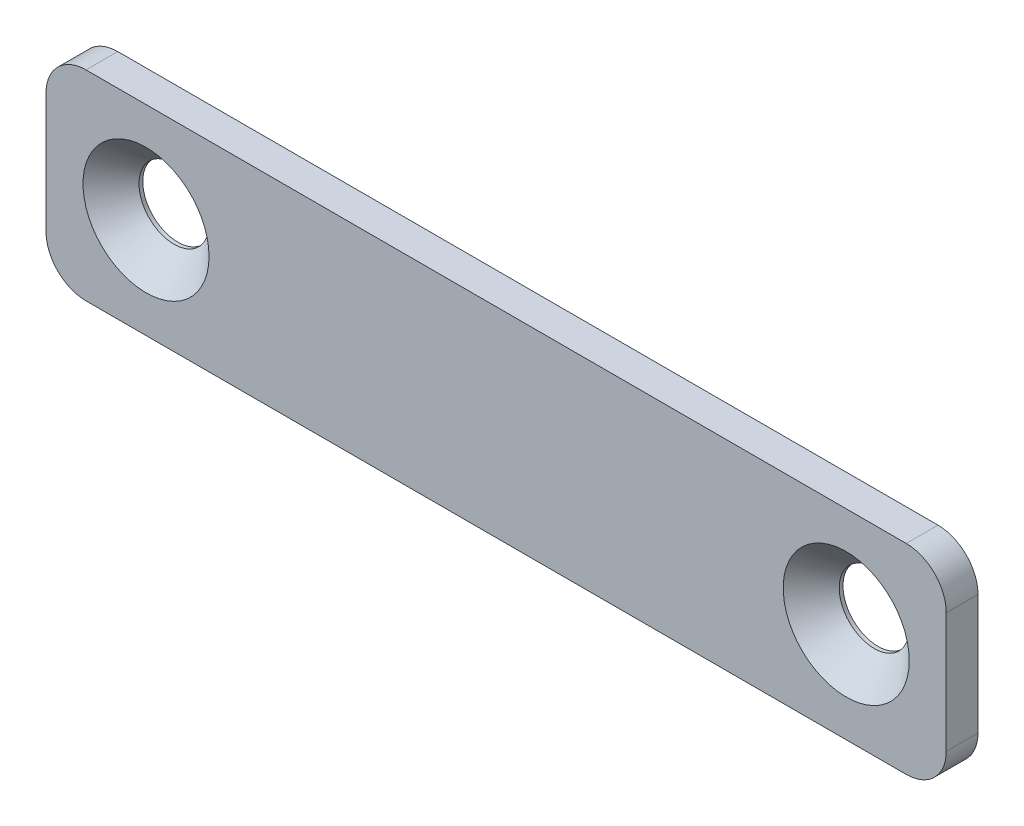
SolidWorks part; units mm, degrees
ref_plane "Front Plane" through (0, 0, 0) normal (0, 0, 1) x (1, 0, 0)
ref_plane "Top Plane" through (0, 0, 0) normal (0, 1, 0) x (1, 0, 0)
ref_plane "Right Plane" through (0, 0, 0) normal (1, 0, 0) x (0, 0, -1)
sketch "Sketch1" plane through (0, 0, 0) normal (0, 0, 1) x (1, 0, 0)
  line L0 (0, 0) -> (17.5, 0) construction
  line L1 (-22.5, -5) -> (22.5, -5)
  line L2 (-22.5, -5) -> (-22.5, 5)
  line L3 (-22.5, 5) -> (22.5, 5)
  line L4 (22.5, -5) -> (22.5, 5)
  line L5 (-22.5, -5) -> (22.5, 5) construction
  line L6 (-22.5, 5) -> (22.5, -5) construction
  line L7 (0, 0) -> (0, 5) construction
  circle A0 centre (17.5, 0) radius 1.75
  circle A1 centre (-17.5, 0) radius 1.75
  point P0 (0, 0)
  dimension "D3" = 35
  dimension "D4" = 3.5
  dimension "D1" = 45
  dimension "D2" = 10
extrude "Boss-Extrude1" add sketch "Sketch1" along normal blind 1.5875
fillet "Fillet1" radius 2 4 edges at (-22.5, 5, 0.7937) (-22.5, -5, 0.7937) (22.5, -5, 0.7937) (22.5, 5, 0.7937)
hole_wizard "CSK for M3 Flat Head Machine Screw1" positions "Sketch3" profile "Sketch2" countersink size "M3" standard "ANSI Metric"
sketch "Sketch3" plane through (0, 0, 1.5875) normal (0, 0, 1) x (1, 0, 0)
  point P0 (-17.5, 0)
  point P3 (17.5, 0)
sketch "Sketch2" plane through (-17.5, 0, 1.5875) normal (1, 0, 0) x (0, -1, 0)
  line L0 (0, 0) -> (0, 1.5875)
  line L1 (0, 1.5875) -> (1.7, 1.5875)
  line L2 (1.7, 1.5875) -> (1.7, 1.45)
  line L3 (1.7, 1.45) -> (3.15, 0)
  line L5 (3.15, 0) -> (0, 0)
  line L6 (-1.7, 1.45) -> (-3.15, 0) construction
  line L11 (0, -6.35) -> (0, 107.95) construction
  dimension "Thru Hole Dia." = 3.4
  dimension "Thru Hole Depth" = 1.5875
  dimension "Near C'Sink Dia." = 6.3
  dimension "Near C'Sink Angle" = 90
